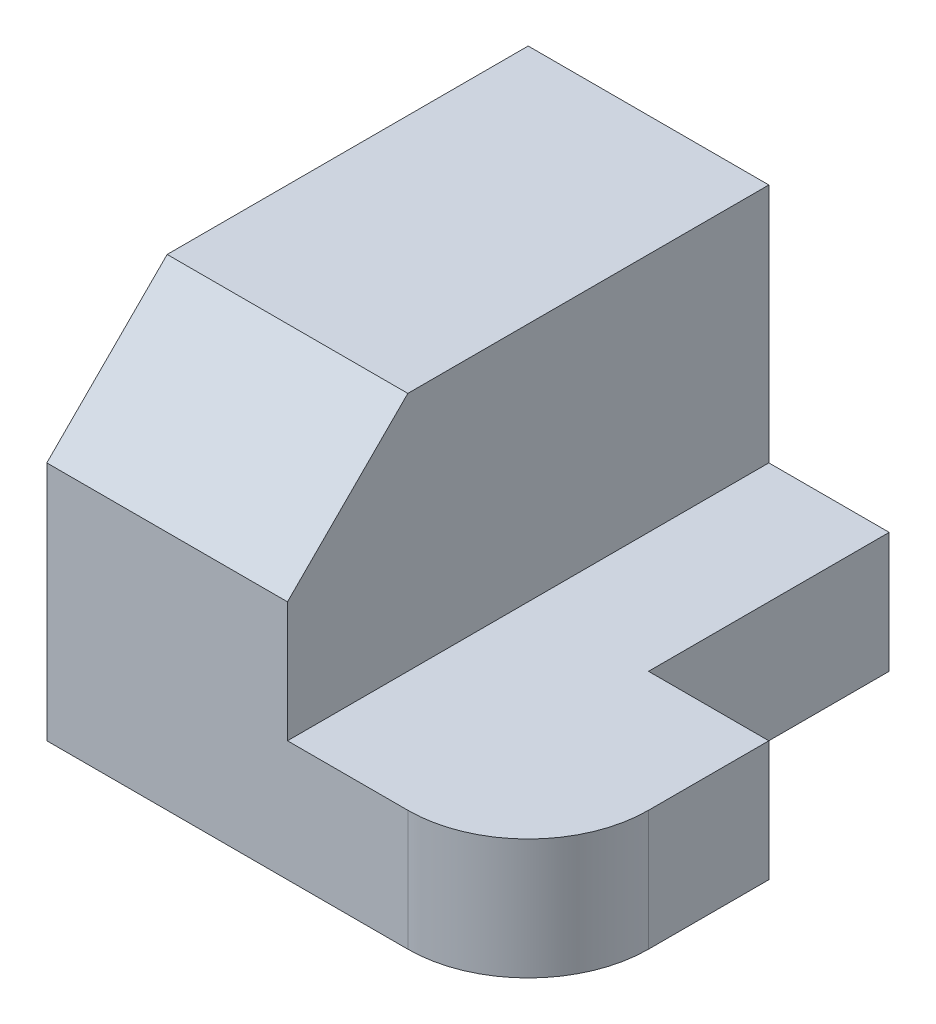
SolidWorks part; units mm, degrees
ref_plane "Front Plane" through (0, 0, 0) normal (0, 0, 1) x (1, 0, 0)
ref_plane "Top Plane" through (0, 0, 0) normal (0, 1, 0) x (1, 0, 0)
ref_plane "Right Plane" through (0, 0, 0) normal (1, 0, 0) x (0, 0, -1)
sketch "Sketch1" plane through (0, 0, 0) normal (0, 1, 0) x (1, 0, 0)
  line L0 (0, 0) -> (0, -40)
  line L1 (0, -40) -> (40, -40)
  line L2 (40, -40) -> (40, -20)
  line L3 (40, -20) -> (30, -20)
  line L4 (30, -20) -> (30, 0)
  line L5 (30, 0) -> (0, 0)
  dimension "D1" = 40
  dimension "D2" = 40
  dimension "D3" = 30
  dimension "D4" = 20
extrude "Extrude1" add sketch "Sketch1" along normal blind 10
sketch "Sketch2" plane through (0, 10, 0) normal (0, 1, 0) x (1, 0, 0)
  line L0 (30, 0) -> (0, 0) construction
  line L1 (0, -40) -> (20, -40)
  line L2 (0, -40) -> (0, 0)
  line L3 (0, 0) -> (20, 0)
  line L4 (20, -40) -> (20, 0)
  dimension "D1" = 20
extrude "Extrude2" add sketch "Sketch2" along normal blind 20
fillet "Fillet1" radius 10 1 edges at (40, 5, 40)
chamfer "Chamfer1" distance 10 angle 45 1 edges at (10, 30, 40)
